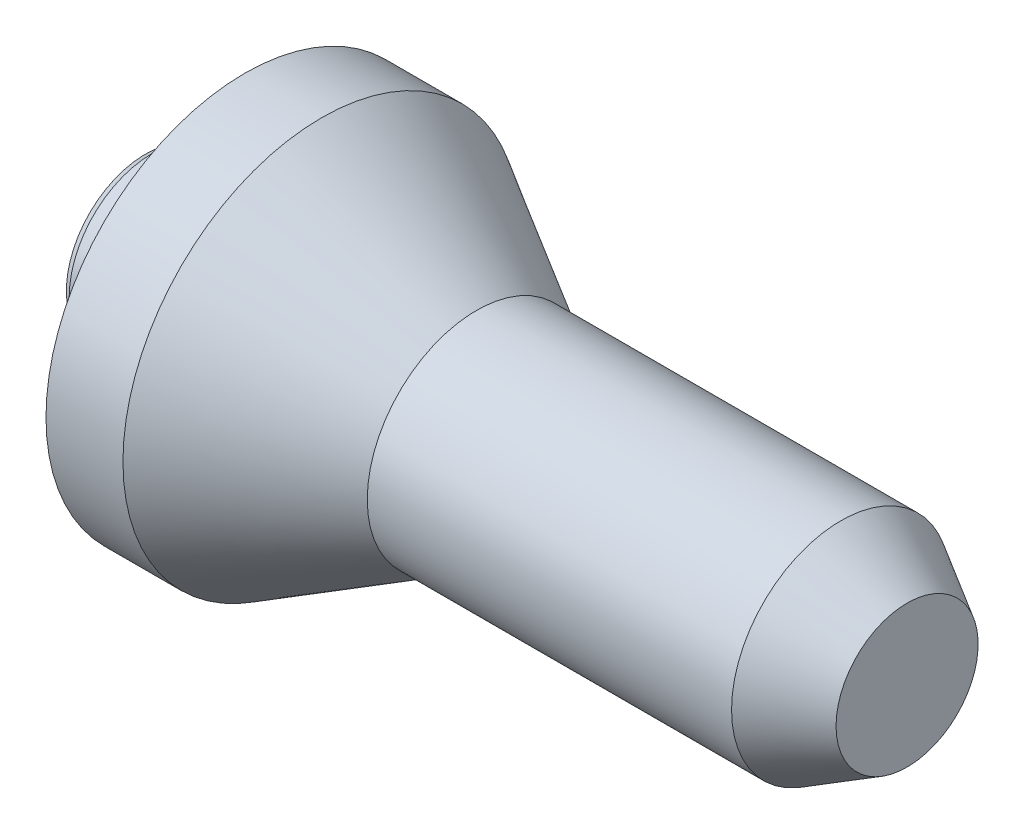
SolidWorks part; units mm, degrees
ref_plane "Plan de face" through (0, 0, 0) normal (0, 0, 1) x (1, 0, 0)
ref_plane "Plan de dessus" through (0, 0, 0) normal (0, 1, 0) x (1, 0, 0)
ref_plane "Plan de droite" through (0, 0, 0) normal (1, 0, 0) x (0, 0, -1)
sketch "Esquisse1" plane through (0, 0, 0) normal (0, 0, 1) x (1, 0, 0)
  line L0 (-16.4655, 0) -> (129.9065, 0) construction
  line L1 (0, 0) -> (0, 12.5)
  line L2 (0, 12.5) -> (15, 12.5)
  line L3 (15, 12.5) -> (15, 30)
  line L4 (50, 16.5) -> (105, 16.5)
  line L5 (105, 16.5) -> (115, 10.7265)
  line L6 (115, 10.7265) -> (115, 0)
  line L7 (115, 0) -> (0, 0)
  line L8 (50, 16.5) -> (26.6173, 30)
  line L9 (26.6173, 30) -> (15, 30)
  dimension "D1" = 25
  dimension "D2" = 33
  dimension "D3" = 15
  dimension "D4" = 115
  dimension "D5" = 30
  dimension "D6" = 10
  dimension "D7" = 35
  dimension "D8" = 150
  dimension "D9" = 60
revolve "Révolution1" add sketch "Esquisse1" angle 360 about L0
hole_wizard "Trou taraudé M16" positions "Esquisse7" profile "Esquisse6" tap size "M16" standard "DIN"
sketch "Esquisse7" plane through (0, 0, 0) normal (-1, 0, 0) x (0, 0, 1)
  point P0 (0, 0)
sketch "Esquisse6" plane through (0, 0, 0) normal (0, 1, 0) x (0, 0, 1)
  line L0 (0, 0) -> (0, 49.206)
  line L1 (0, 49.206) -> (7, 45)
  line L2 (7, 45) -> (7, 1.25)
  line L3 (7, 1.25) -> (8.25, 0)
  line L5 (8.25, 0) -> (0, 0)
  line L6 (-7, 1.25) -> (-8.25, 0) construction
  line L10 (0, 49.206) -> (-7, 45) construction
  line L11 (0, -6.35) -> (0, 107.95) construction
  dimension "Diamètre du trou pour taraudage" = 14
  dimension "Profondeur du trou pour taraudage" = 45
  dimension "Diamètre du fraisage entrant" = 16.5
  dimension "Angle du fraisage entrant" = 90
  dimension "Angle de pointe" = 118
chamfer "Chanfrein1" distance 1 angle 30 1 edges at (0, 0, 12.5)
